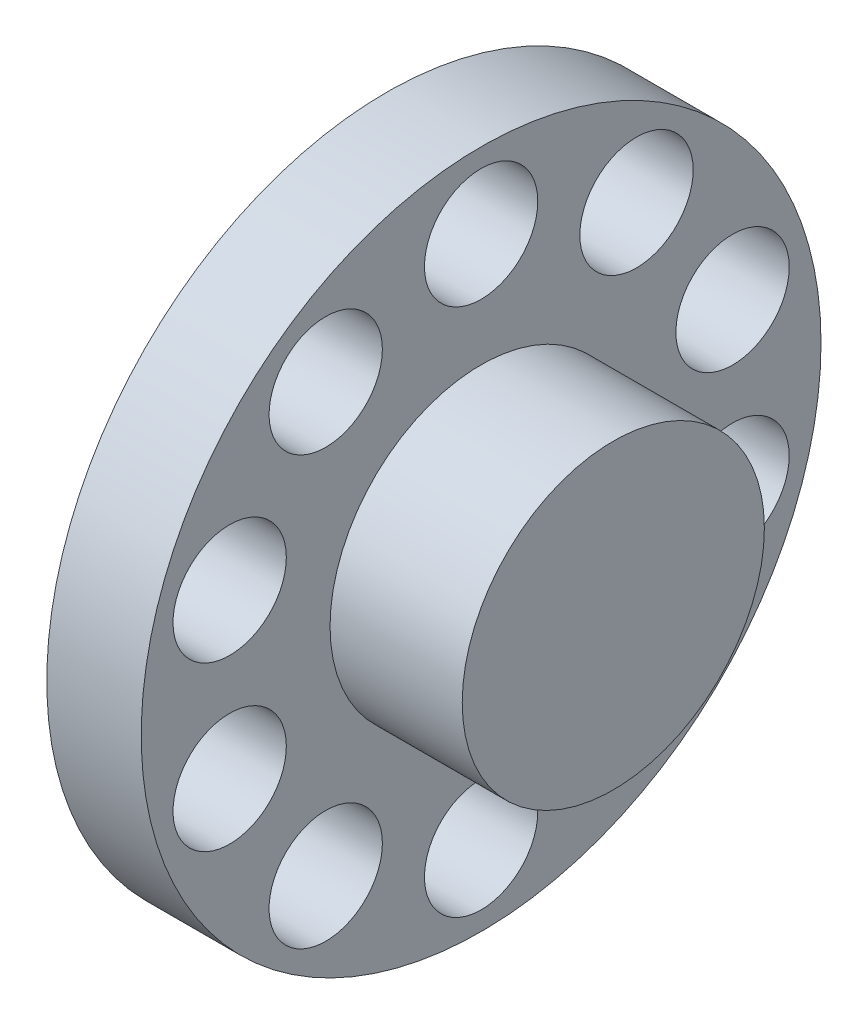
SolidWorks part; units mm, degrees
ref_plane "Płaszczyzna przednia" through (0, 0, 0) normal (0, 0, 1) x (1, 0, 0)
ref_plane "Płaszczyzna górna" through (0, 0, 0) normal (0, 1, 0) x (1, 0, 0)
ref_plane "Płaszczyzna prawa" through (0, 0, 0) normal (1, 0, 0) x (0, 0, -1)
sketch "Szkic bazowy" plane through (0, 0, 0) normal (0, 0, 1) x (1, 0, 0)
  line L0 (0, 0) -> (-52.1059, 0) construction
  line L1 (0, 0) -> (0, 90)
  line L2 (0, 90) -> (25, 90)
  line L3 (25, 90) -> (25, 40)
  line L4 (25, 40) -> (60, 40)
  line L5 (60, 40) -> (60, 0)
  line L6 (60, 0) -> (0, 0)
  dimension "D1" = 180
  dimension "D2" = 80
  dimension "D3" = 25
  dimension "Długość" = 60
revolve "Obrót bazowy" add sketch "Szkic bazowy" angle 360 about L0
sketch "Szkic otworu środkowego" plane through (60, 0, 0) normal (1, 0, 0) x (0, 0, -1)
  circle A0 centre (0, 0) radius 20
  dimension "D1" = 40
extrude "Otwór środkowy" [suppressed] cut sketch "Szkic otworu środkowego" against normal through all
sketch "Szkic otworu mocowania" plane through (0, 0, 0) normal (-1, 0, 0) x (0, 0, 1)
  circle A6 centre (0, 0) radius 70 construction
  circle A7 centre (0, 70) radius 15
  dimension "D1" = 140
  dimension "D2" = 30
extrude "Otwór mocowania" cut sketch "Szkic otworu mocowania" against normal through all
pattern_circular "Powielenie otworów" count 10 over 360 about axis through (0, 0, 0) along (1, 0, 0) of "Otwór mocowania"
